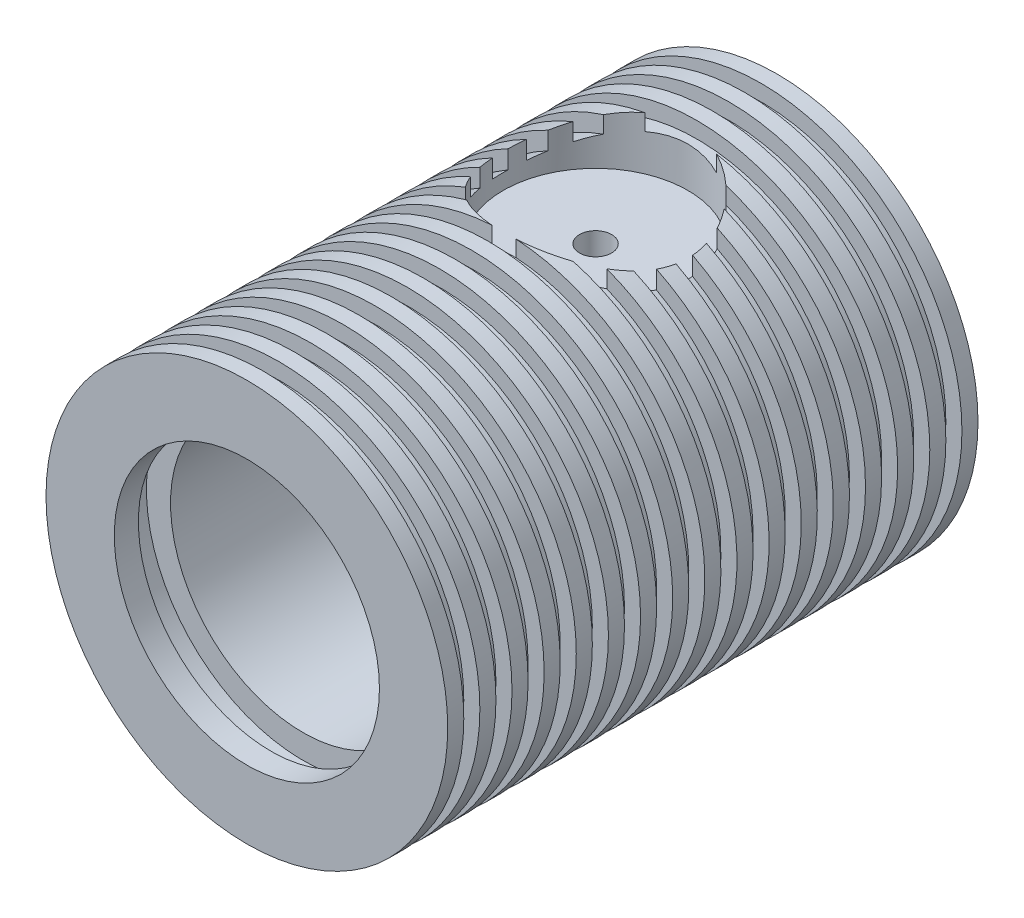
SolidWorks part; units mm, degrees
ref_plane "Front Plane" through (0, 0, 0) normal (0, 0, 1) x (1, 0, 0)
ref_plane "Top Plane" through (0, 0, 0) normal (0, 1, 0) x (1, 0, 0)
ref_plane "Right Plane" through (0, 0, 0) normal (1, 0, 0) x (0, 0, -1)
sketch "Sketch1" plane through (0, 0, 0) normal (0, 0, 1) x (1, 0, 0)
  circle A0 centre (0, 0) radius 12.5
  dimension "D1" = 25
extrude "CylinderOD" add sketch "Sketch1" along normal mid plane 33
sketch "Sketch2" plane through (0, 0, 16.5) normal (0, 0, 1) x (1, 0, 0)
  circle A0 centre (0, 0) radius 8.25
  dimension "D1" = 16.5
extrude "Cut-Extrude1" cut sketch "Sketch2" against normal blind 20.5
sketch "Sketch3" plane through (0, 0, -4) normal (0, 0, 1) x (1, 0, 0)
  circle A0 centre (0, 0) radius 7.25
  dimension "D1" = 14.5
extrude "Cut-Extrude2" cut sketch "Sketch3" against normal blind 3.5
sketch "Sketch4" plane through (0, 0, -7.5) normal (0, 0, 1) x (1, 0, 0)
  circle A0 centre (0, 0) radius 3
  dimension "D1" = 6
extrude "Cut-Extrude3" cut sketch "Sketch4" against normal blind 8
sketch "Sketch5" plane through (0, 0, -15.5) normal (0, 0, 1) x (1, 0, 0)
  circle A0 centre (0, 0) radius 1.25
  dimension "D1" = 2.5
extrude "piston shaft hole" cut sketch "Sketch5" against normal blind 1
sketch "Sketch7" plane through (0, 0, 0) normal (1, 0, 0) x (0, 0, -1)
  line L0 (-16.5, -8.25) -> (4, -8.25) construction
  line L1 (-15, -8.25) -> (-13, -8.25)
  line L2 (-15, -8.25) -> (-15, -9.75)
  line L3 (-15, -9.75) -> (-13, -9.75)
  line L4 (-13, -8.25) -> (-13, -9.75)
  line L5 (-16.5, 12.5) -> (-16.5, -12.5) construction
  line L6 (-3.5, -8.25) -> (-1.5, -8.25)
  line L7 (-3.5, -8.25) -> (-3.5, -9.75)
  line L8 (-3.5, -9.75) -> (-1.5, -9.75)
  line L9 (-1.5, -8.25) -> (-1.5, -9.75)
  dimension "D1" = 9.75
  dimension "D2" = 2
  dimension "D3" = 1.5
  dimension "D4" = 13
  dimension "D5" = 9.75
revolve "ID Grooves" cut sketch "Sketch7" angle 360 about axis through (0, 0, 16.5) along (0, 0, -1)
sketch "Sketch8" plane through (0, 0, -16.5) normal (0, 0, -1) x (-1, 0, 0)
  line L0 (0, -14.0093) -> (0, 14.5249) construction
  circle A0 centre (0, 8) radius 2
  circle A2 centre (0, 0) radius 12.5 construction
  dimension "D1" = 4
  dimension "D3" = 20.5
extrude "mount hole top" cut sketch "Sketch8" against normal blind 5
sketch "Sketch9" plane through (0, 0, -16.5) normal (0, 0, -1) x (-1, 0, 0)
  circle A0 centre (0, -8) radius 2
  circle A1 centre (0, 0) radius 12.5 construction
  dimension "D1" = 4
  dimension "D2" = 20.5
extrude "mount hole bottom" cut sketch "Sketch9" against normal blind 8
sketch "Sketch10" plane through (0, 0, 0) normal (1, 0, 0) x (0, 0, -1)
  line L0 (0, 0) -> (0, 12.5) construction
  line L1 (16.5, 12.5) -> (-16.5, 12.5) construction
ref_plane "Plane1" through (0, 12.5, 0) normal (0, 1, 0) x (1, 0, 0)
sketch "Sketch12" plane through (0, 12.5, 0) normal (0, 1, 0) x (1, 0, 0)
  line L0 (12.5, 16.5) -> (-12.5, 16.5) construction
  circle A0 centre (0, 5.2) radius 5.75
  dimension "D1" = 11.5
  dimension "D2" = 11.3
extrude "power cylinder bore" cut sketch "Sketch12" against normal blind 3.5
sketch "Sketch14" plane through (0, 9, 0) normal (0, 1, 0) x (1, 0, 0)
  circle A0 centre (0, 5.2) radius 1
  dimension "D1" = 2
extrude "Air hole" cut sketch "Sketch14" against normal up to next
sketch "Sketch15" plane through (0, 0, 0) normal (1, 0, 0) x (0, 0, -1)
  line L0 (-0.55, 12.5) -> (-16.5, 12.5) construction
  line L1 (-15.5, 12.5) -> (-14.5, 12.5)
  line L2 (-15.5, 12.5) -> (-15.5, 11.5)
  line L3 (-15.5, 11.5) -> (-14.5, 11.5)
  line L4 (-14.5, 12.5) -> (-14.5, 11.5)
  line L5 (-16.5, 12.5) -> (-16.5, -12.5) construction
  dimension "D1" = 1
  dimension "D2" = 1
  dimension "D3" = 11.5
revolve "Cut-Revolve2" cut sketch "Sketch15" angle 360 about axis through (0, 0, 16.5) along (0, 0, -1)
pattern_linear "LPattern1" count 16 spacing 2 along (0, 0, -1) of "Cut-Revolve2"
